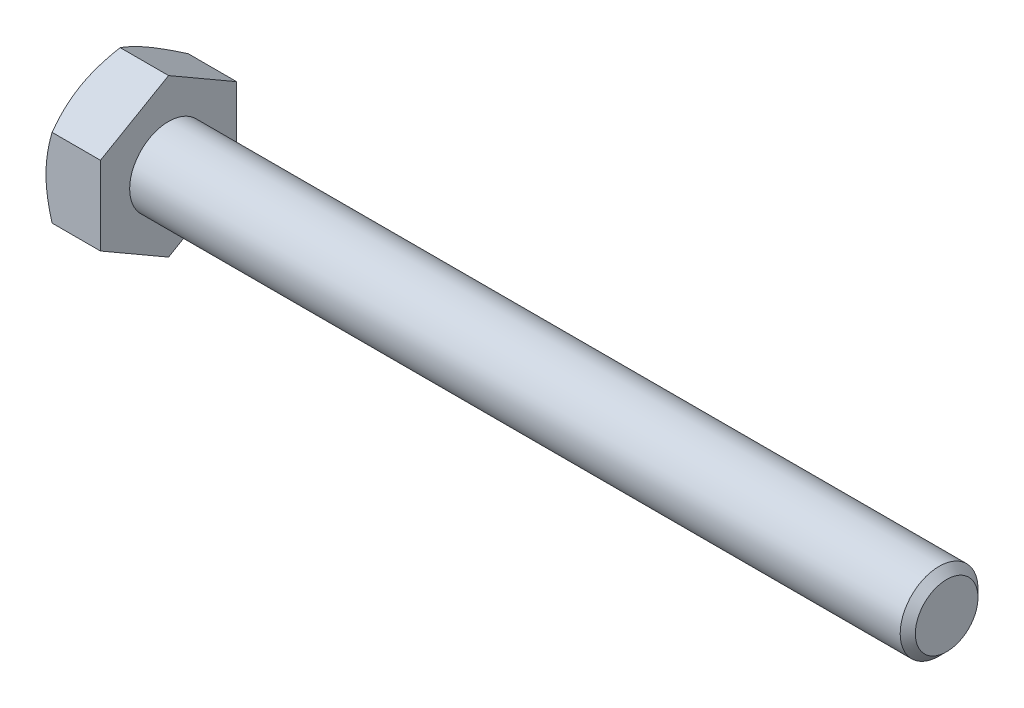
SolidWorks part; units mm, degrees
extrude "BaseHead" add sketch "Sketch1" along normal blind 2.8
sketch "Sketch1" plane through (0, 0, 0) normal (1, 0, 0) x (0, 0, -1)
  line L0 (3.5, 2.0207) -> (3.5, -2.0207)
  line L1 (-3.5, 2.0207) -> (-3.5, -2.0207)
  line L2 (3.5, -2.0207) -> (0, -4.0415)
  line L3 (0, -4.0415) -> (-3.5, -2.0207)
  line L4 (3.5, 2.0207) -> (0, 4.0415)
  line L5 (0, 4.0415) -> (-3.5, 2.0207)
ref_plane "Plane1" through (0, 0, 0) normal (0, 0, 1) x (1, 0, 0)
ref_plane "Plane2" through (0, 0, 0) normal (0, 1, 0) x (1, 0, 0)
ref_plane "Plane3" through (0, 0, 0) normal (1, 0, 0) x (0, 0, -1)
other "Configuration Table"
sketch "BodySke" plane through (0, 0, 0) normal (0, 0, 1) x (1, 0, 0)
  line L1 (0, 0) -> (42.8, 0)
  line L2 (0, 0) -> (0, 2)
  line L4 (42.8, 0) -> (42.8, 1.61)
  line L5 (2.8, 4.0415) -> (2.8, 2.0207) construction
  line L6 (42.8, 1.61) -> (42.41, 2)
  line L7 (0, 0) -> (110.49, 0) construction
  line L8 (42.8, -1.61) -> (42.41, -2) construction
  line L9 (0, 2.0207) -> (0, -2.0207) construction
  line L10 (3.5, 15.24) -> (3.5, -1.27) construction
  line L11 (28.8, 15.24) -> (28.8, -1.27) construction
  line L12 (2.8, 2.0207) -> (2.8, -2.0207) construction
  line L15 (0, 2) -> (42.41, 2)
revolve "BaseBody" add sketch "BodySke" angle 360 about L7
fillet "HeadFillet" [suppressed] radius 0.2
sketch "Sketch3" plane through (0, 0, 0) normal (0, 0, 1) x (1, 0, 0)
  line L0 (0, 3.5) -> (3.1994, 9.0415)
  line L1 (0, 4.0415) -> (0, 2.0207) construction
  line L2 (3.1994, 9.0415) -> (3.1994, 14.0415)
  line L3 (3.1994, 14.0415) -> (-10, 14.0415)
  line L4 (-10, 14.0415) -> (-10, 3.5)
  line L5 (-10, 3.5) -> (0, 3.5)
  line L6 (0, 0) -> (99.06, 0) construction
  line L7 (2.8, 4.0415) -> (0, 4.0415) construction
revolve "HeadChamfer" cut sketch "Sketch3" angle 360 about L6
sketch "ThdSchSke" plane through (0, 0, 0) normal (0, 0, 1) x (1, 0, 0)
  line L0 (28.8, -1.61) -> (28.5269, -2)
  line L1 (28.8, -1.61) -> (29.0731, -2)
  line L2 (29.0731, -2) -> (29.0731, -2.5)
  line L3 (-3.175, 0) -> (5.1513, 0) construction
  line L5 (29.0731, -2.5) -> (28.5269, -2.5)
  line L6 (28.5269, -2.5) -> (28.5269, -2)
revolve "ThreadSchematic" [suppressed] cut sketch "ThdSchSke" angle 360 about L3
pattern_linear "ThdSchPat" [suppressed]
equation "\"D3@Sketch1\" = \"Width_flats@Sketch1\" / 2"
equation "\"D4@Sketch1\" = \"D3@Sketch1\""
equation "\"D5@Sketch1\" = \"D4@Sketch1\""
equation "\"Thread_minor@ThreadCosmetic\" = \"Minor_dia@BodySke\""
equation "\"D1@Sketch3\" = \"Width_flats@Sketch1\" / 2"
equation "\"Thread_length@ThreadCosmetic\" = ((sgn( (\"Length@BodySke\" - \"Advance@BodySke\" ) - \"Thread_nom@BodySke\" )-1)*( (\"Length@BodySke\" - \"Advance@BodySke\" ) - \"Thread_nom@BodySke\" ))/-2+ \"Thread_nom@BodySke\""
equation "\"Thread_minor@ThdSchSke\" = \"Minor_dia@BodySke\""
equation "\"Diameter@ThdSchSke\" = \"Diameter@BodySke\""
equation "\"Overcut@ThdSchSke\" = \"Diameter@BodySke\" * 1.25"
equation "\"Start@ThdSchSke\" = \"Head_ht@BaseHead\" + \"Length@BodySke\" - \"Thread_length@ThreadCosmetic\"  '---Non-countersunk---"
equation "\"Num_threads@ThdSchPat\" = int( \"Thread_length@ThreadCosmetic\" / \"Advance@BodySke\" + 0.999 )  + 1"
equation "\"Advance@ThdSchPat\" = \"Thread_length@ThreadCosmetic\" /  (\"Num_threads@ThdSchPat\" - 1) 'relax it"
equation "\"Num_threads@ThdSchPat\" = \"Num_threads@ThdSchPat\" - sgn( \"Num_threads@ThdSchPat\" - 1) '---chamfered tips only---"
